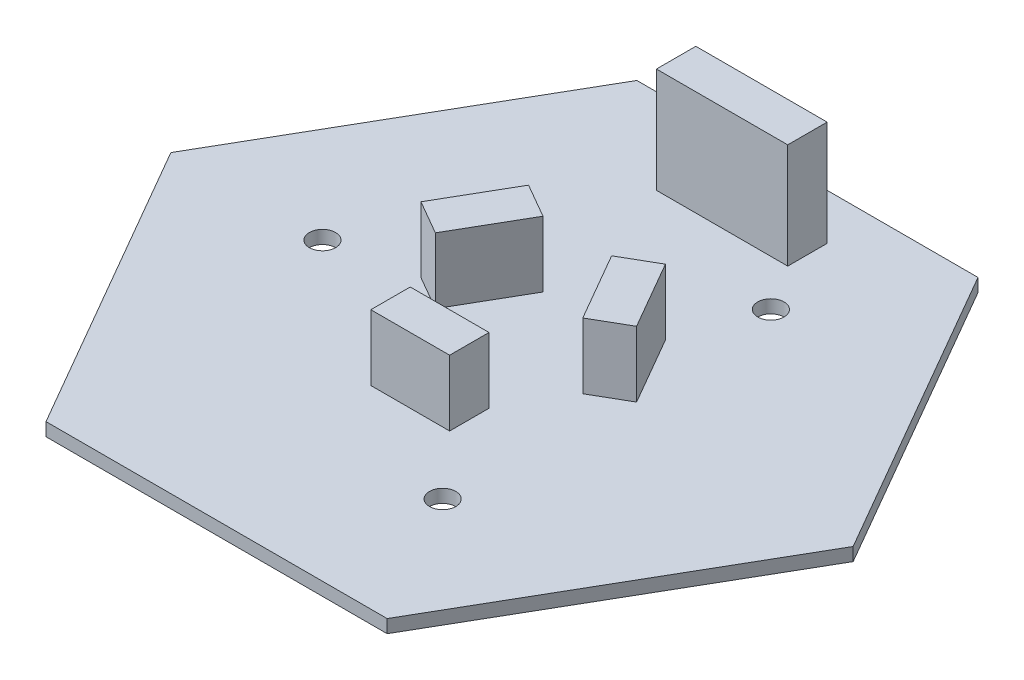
SolidWorks part; units mm, degrees
ref_plane "Front Plane" through (0, 0, 0) normal (0, 0, 1) x (1, 0, 0)
ref_plane "Top Plane" through (0, 0, 0) normal (0, 1, 0) x (1, 0, 0)
ref_plane "Right Plane" through (0, 0, 0) normal (1, 0, 0) x (0, 0, -1)
sketch "Sketch1" plane through (0, 0, 0) normal (0, 1, 0) x (1, 0, 0)
  line L0 (12.9904, 22.5) -> (-25.9808, 0) construction
  line L1 (25.9808, 0) -> (12.9904, 22.5)
  line L2 (12.9904, 22.5) -> (6, 22.5)
  line L3 (-12.9904, 22.5) -> (-25.9808, 0)
  line L4 (-25.9808, 0) -> (-22.4856, -6.0538)
  line L5 (-12.9904, -22.5) -> (12.9904, -22.5)
  line L6 (12.9904, -22.5) -> (16.4856, -16.4462)
  line L7 (12.9904, -22.5) -> (12.9904, 22.5) construction
  line L8 (-25.9808, 0) -> (12.9904, -22.5) construction
  line L9 (7.2169, 12.5) -> (-14.4338, 0) construction
  line L10 (-14.4338, 0) -> (7.2169, -12.5) construction
  line L11 (7.2169, -12.5) -> (7.2169, 12.5) construction
  line L12 (0, 22.5) -> (-6, 22.5)
  line L13 (0, 22.5) -> (6, 22.5)
  line L17 (-6, 22.5) -> (-12.9904, 22.5)
  line L18 (-6, 22.5) -> (0, 22.5) construction
  line L19 (6, 22.5) -> (0, 22.5) construction
  line L26 (19.4856, -11.25) -> (22.4856, -6.0538)
  line L27 (22.4856, -6.0538) -> (25.9808, 0)
  line L28 (16.4856, -16.4462) -> (19.4856, -11.25)
  line L29 (-19.4856, -11.25) -> (-16.4856, -16.4462)
  line L30 (-16.4856, -16.4462) -> (-12.9904, -22.5)
  line L31 (-22.4856, -6.0538) -> (-19.4856, -11.25)
  arc A0 (-6, 21.6852) -> (-21.78, -5.6465) centre (0, 0) ccw construction
  circle A1 centre (7.2169, 12.5) radius 1
  circle A2 centre (7.2169, -12.5) radius 1
  circle A3 centre (-14.4338, 0) radius 1
  arc A4 (0, 22.5) -> (-6, 21.6852) centre (0, 0) ccw construction
  arc A5 (6, 21.6852) -> (0, 22.5) centre (0, 0) ccw construction
  arc A6 (19.4856, -11.25) -> (21.78, -5.6465) centre (0, 0) ccw construction
  arc A7 (21.78, -5.6465) -> (6, 21.6852) centre (0, 0) ccw construction
  arc A8 (15.78, -16.0388) -> (19.4856, -11.25) centre (0, 0) ccw construction
  arc A9 (-19.4856, -11.25) -> (-15.78, -16.0388) centre (0, 0) ccw construction
  arc A10 (-15.78, -16.0388) -> (15.78, -16.0388) centre (0, 0) ccw construction
  arc A11 (-21.78, -5.6465) -> (-19.4856, -11.25) centre (0, 0) ccw construction
  point P19 (0, 0)
  point P32 (0, 0)
  dimension "D3" = 2
  dimension "D1" = 45
  dimension "D2" = 25
extrude "Boss-Extrude1" add sketch "Sketch1" along normal blind 1
sketch "Sketch2" plane through (0, 1, 0) normal (0, 1, 0) x (1, 0, 0)
  line L24 (-8.2272, -4.75) -> (0, 9.5) construction
  line L25 (0, 9.5) -> (8.2272, -4.75) construction
  line L26 (8.2272, -4.75) -> (-8.2272, -4.75) construction
  line L27 (5.6136, -0.2231) -> (2.6136, 4.9731)
  line L28 (5.6136, -0.2231) -> (8.2117, 1.2769)
  line L29 (2.6136, 4.9731) -> (5.2117, 6.4731)
  line L30 (8.2117, 1.2769) -> (5.2117, 6.4731)
  line L39 (3, -4.75) -> (3, -7.75)
  line L40 (-3, -7.75) -> (3, -7.75)
  line L41 (-3, -4.75) -> (-3, -7.75)
  line L42 (-3, -4.75) -> (3, -4.75)
  line L43 (-5.6136, -0.2231) -> (-8.2117, 1.2769)
  line L44 (-5.2117, 6.4731) -> (-8.2117, 1.2769)
  line L45 (-2.6136, 4.9731) -> (-5.2117, 6.4731)
  line L46 (-2.6136, 4.9731) -> (-5.6136, -0.2231)
  line L48 (0, 22.5) -> (-19.4856, -11.25) construction
  line L49 (-25.9808, 0) -> (-12.9904, -22.5) construction
  line L50 (-19.4856, -11.25) -> (19.4856, -11.25) construction
  line L51 (12.9904, -22.5) -> (25.9808, 0) construction
  line L52 (19.4856, -11.25) -> (0, 22.5) construction
  point P0 (0, 0)
  point P7 (0, 0)
  point P12 (4.1136, 2.375)
  point P18 (0, 0)
  point P26 (4.1136, 2.375)
  point P28 (0, 0)
  point P29 (0, 0)
  point P30 (-13.2625, 0.4397)
  point P31 (0, 0)
  point P32 (-8.2117, -4.75)
  dimension "D2" = 3
  dimension "D3" = 6
  dimension "D1" = 6.5
  dimension "D5" = 6.5
  dimension "D6" = 6.5
  dimension "D4" = 3
extrude "Boss-Extrude2" add sketch "Sketch2" along normal blind 5
sketch "Sketch3" plane through (0, 1, 0) normal (0, 1, 0) x (1, 0, 0)
  line L3 (-5, 19) -> (5, 19)
  line L7 (12.9904, 19) -> (-12.9904, 19)
  line L8 (12.9904, 19) -> (-12.9904, 19)
  line L9 (-5, 19) -> (-5, 16)
  line L10 (5, 19) -> (5, 16)
  line L11 (-5, 16) -> (5, 16)
  point P0 (-11.322, 19)
  point P3 (0, 16)
  point P8 (0, 19)
  dimension "D2" = 10
  dimension "D3" = 3
  dimension "D1" = 3.5
extrude "Boss-Extrude3" add sketch "Sketch3" along normal blind 8 contours L9 L11 L10 L3
